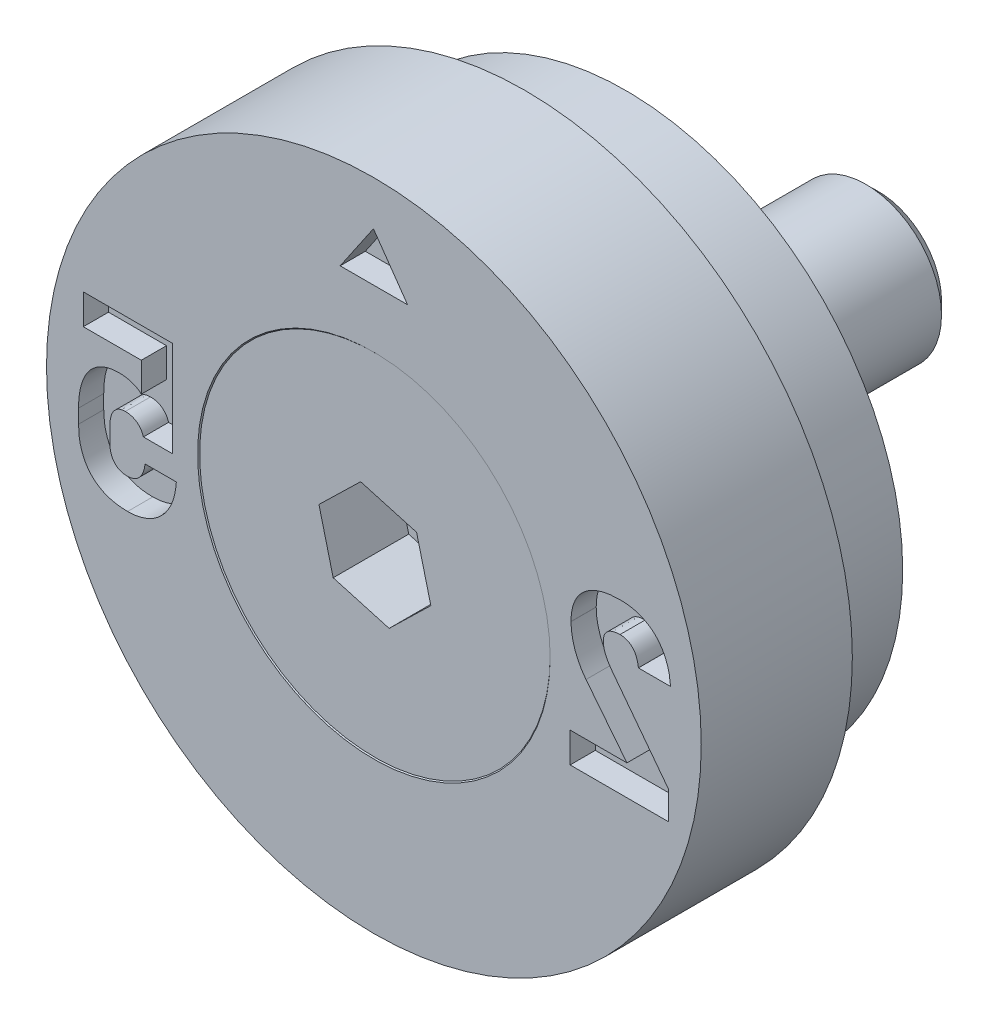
SolidWorks part; units mm, degrees
other "<M3 X .5 FHCS>-<Imported1>"
ref_plane "Front Plane" through (0, 0, 0) normal (0, 0, 1) x (1, 0, 0)
ref_plane "Top Plane" through (0, 0, 0) normal (0, 1, 0) x (1, 0, 0)
ref_plane "Right Plane" through (0, 0, 0) normal (1, 0, 0) x (0, 0, -1)
imported_body "Imported1"
sketch "Sketch1" plane through (0, 0, 0) normal (0, 0, 1) x (1, 0, 0)
  text T0 "2      5" font "Bahnschrift" height 3.302
  dimension "D1" = 1.651
extrude "Cut-Extrude1" cut sketch "Sketch1" against normal blind 0.5
inserted part "M3 X .5 FHCS"
move or copy body "Body-Move/Copy2" placed by mates yes
